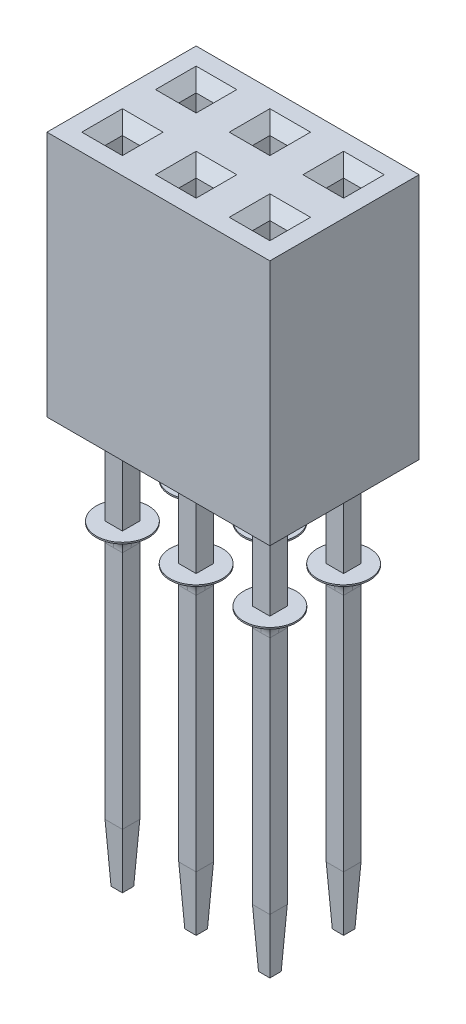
SolidWorks part; units mm, degrees
ref_plane "Plan de face" through (0, 0, 0) normal (0, 0, 1) x (1, 0, 0)
ref_plane "Plan de dessus" through (0, 0, 0) normal (0, 1, 0) x (1, 0, 0)
ref_plane "Plan de droite" through (0, 0, 0) normal (1, 0, 0) x (0, 0, -1)
sketch "Esquisse1" plane through (0, 0, 0) normal (0, 1, 0) x (1, 0, 0)
  line L1 (-1.3, -1.3) -> (1.3, -1.3)
  line L2 (-1.3, -1.3) -> (-1.3, 1.3)
  line L3 (-1.3, 1.3) -> (1.3, 1.3)
  line L4 (1.3, -1.3) -> (1.3, 1.3)
  line L5 (-1.3, -1.3) -> (1.3, 1.3) construction
  line L6 (-1.3, 1.3) -> (1.3, -1.3) construction
  line L7 (-0.3, -0.3) -> (0.3, -0.3)
  line L8 (-0.3, -0.3) -> (-0.3, 0.3)
  line L9 (-0.3, 0.3) -> (0.3, 0.3)
  line L10 (0.3, -0.3) -> (0.3, 0.3)
  line L11 (-0.3, -0.3) -> (0.3, 0.3) construction
  line L12 (-0.3, 0.3) -> (0.3, -0.3) construction
  point P0 (0, 0)
  point P5 (0, 0)
  dimension "D1" = 2.6
  dimension "D2" = 0.6
extrude "Boss.-Extru.1" add sketch "Esquisse1" along normal blind 8.5
chamfer "Chanfrein1" distance 0.4 angle 45 4 edges at (0.3, 8.5, 0) (0, 8.5, 0.3) (-0.3, 8.5, 0) (0, 8.5, -0.3)
sketch "Esquisse2" plane through (0, 0, 0) normal (0, -1, 0) x (1, 0, 0)
  line L1 (-0.3, -0.3) -> (0.3, -0.3)
  line L2 (-0.3, -0.3) -> (-0.3, 0.3)
  line L3 (-0.3, 0.3) -> (0.3, 0.3)
  line L4 (0.3, -0.3) -> (0.3, 0.3)
extrude "Boss.-Extru.2" add sketch "Esquisse2" along normal blind 14 separate body
chamfer "Chanfrein2" distance 2 angle 3 4 edges at (0, -14, 0.3) (0.3, -14, 0) (0, -14, -0.3) (-0.3, -14, 0)
ref_plane "Plan1" through (0, -3.1, 0) normal (0, -1, 0) x (-1, 0, 0)
sketch "Esquisse4" plane through (0, -3.1, 0) normal (0, -1, 0) x (-1, 0, 0)
  circle A0 centre (0, 0) radius 0.9
extrude "Boss.-Extru.3" add sketch "Esquisse4" along normal blind 0.05
fillet "Congé1" radius 0.6 4 edges at (0, -3.15, -0.3) (0.3, -3.15, 0) (0, -3.15, 0.3) (-0.3, -3.15, 0)
pattern_linear "Répétition linéaire4" count 3 spacing 2.54 along (1, 0, 0) count 2 spacing 2.54 along (0, 0, 1) of "Boss.-Extru.1", "Chanfrein1"
pattern_linear "Répétition linéaire6" count 3 spacing 2.54 count 2 spacing 2.54
